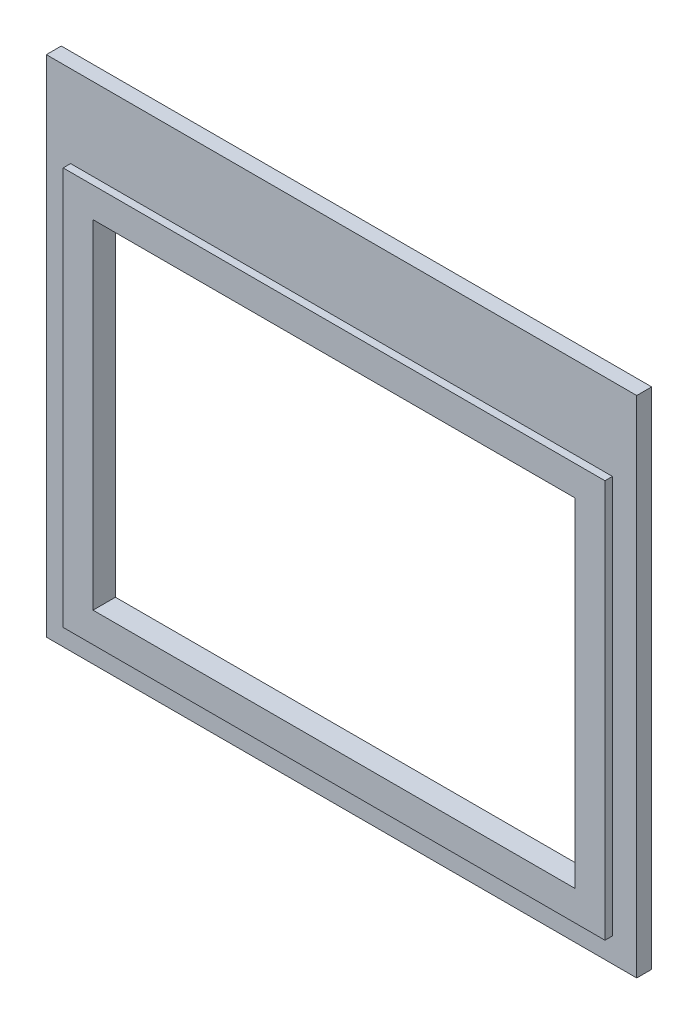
SolidWorks part; units mm, degrees
ref_plane "Plan de face" through (0, 0, 0) normal (0, 0, 1) x (1, 0, 0)
ref_plane "Plan de dessus" through (0, 0, 0) normal (0, 1, 0) x (1, 0, 0)
ref_plane "Plan de droite" through (0, 0, 0) normal (1, 0, 0) x (0, 0, -1)
sketch "Esquisse1" plane through (0, 0, 0) normal (0, 0, 1) x (1, 0, 0)
  line L1 (-98.5286, 70.7259) -> (59.4714, 70.7259)
  line L2 (-98.5286, 70.7259) -> (-98.5286, -64.2741)
  line L3 (-98.5286, -64.2741) -> (59.4714, -64.2741)
  line L4 (59.4714, 70.7259) -> (59.4714, -64.2741)
  dimension "D1" = 158
  dimension "D2" = 135
extrude "Boss.-Extru.1" add sketch "Esquisse1" along normal blind 6
sketch "Esquisse5" plane through (0, 0, 6) normal (0, 0, 1) x (1, 0, 0)
  line L0 (59.4714, 70.7259) -> (59.4714, -64.2741)
  line L1 (59.4714, -64.2741) -> (-98.5286, -64.2741)
  line L2 (-98.5286, -64.2741) -> (-98.5286, 70.7259)
  line L3 (-98.5286, 70.7259) -> (-92.0286, 70.7259)
  line L4 (59.4714, 70.7259) -> (-98.5286, 70.7259) construction
  line L5 (-92.0286, 70.7259) -> (-92.0286, -57.7741)
  line L6 (-92.0286, -57.7741) -> (52.9714, -57.7741)
  line L7 (52.9714, -57.7741) -> (52.9714, 70.7259)
  line L8 (52.9714, 70.7259) -> (59.4714, 70.7259)
  dimension "D1" = 6.5
  dimension "D2" = 6.5
  dimension "D3" = 6.5
extrude "Enlèv. mat.-Extru.3" cut sketch "Esquisse5" against normal blind 2
sketch "Esquisse6" plane through (0, 0, 6) normal (0, 0, 1) x (1, 0, 0)
  line L0 (52.9714, 70.7259) -> (52.9714, -57.7741) construction
  line L1 (-92.0286, 70.7259) -> (52.9714, 70.7259)
  line L2 (-92.0286, 70.7259) -> (-92.0286, 48.7259)
  line L3 (-92.0286, 48.7259) -> (52.9714, 48.7259)
  line L4 (52.9714, 70.7259) -> (52.9714, 48.7259)
  dimension "D1" = 22
extrude "Enlèv. mat.-Extru.4" cut sketch "Esquisse6" against normal blind 2
sketch "Esquisse7" plane through (0, 0, 6) normal (0, 0, 1) x (1, 0, 0)
  line L0 (52.9714, 48.7259) -> (52.9714, -57.7741) construction
  line L1 (-84.0286, 40.7259) -> (44.9714, 40.7259)
  line L2 (-84.0286, 40.7259) -> (-84.0286, -49.7741)
  line L3 (-84.0286, -49.7741) -> (44.9714, -49.7741)
  line L4 (44.9714, 40.7259) -> (44.9714, -49.7741)
  line L5 (-92.0286, 48.7259) -> (52.9714, 48.7259) construction
  line L6 (-92.0286, -57.7741) -> (-92.0286, 48.7259) construction
  line L7 (52.9714, -57.7741) -> (-92.0286, -57.7741) construction
  dimension "D1" = 8
  dimension "D2" = 8
  dimension "D3" = 8
  dimension "D4" = 8
extrude "Enlèv. mat.-Extru.5" cut sketch "Esquisse7" against normal through all
